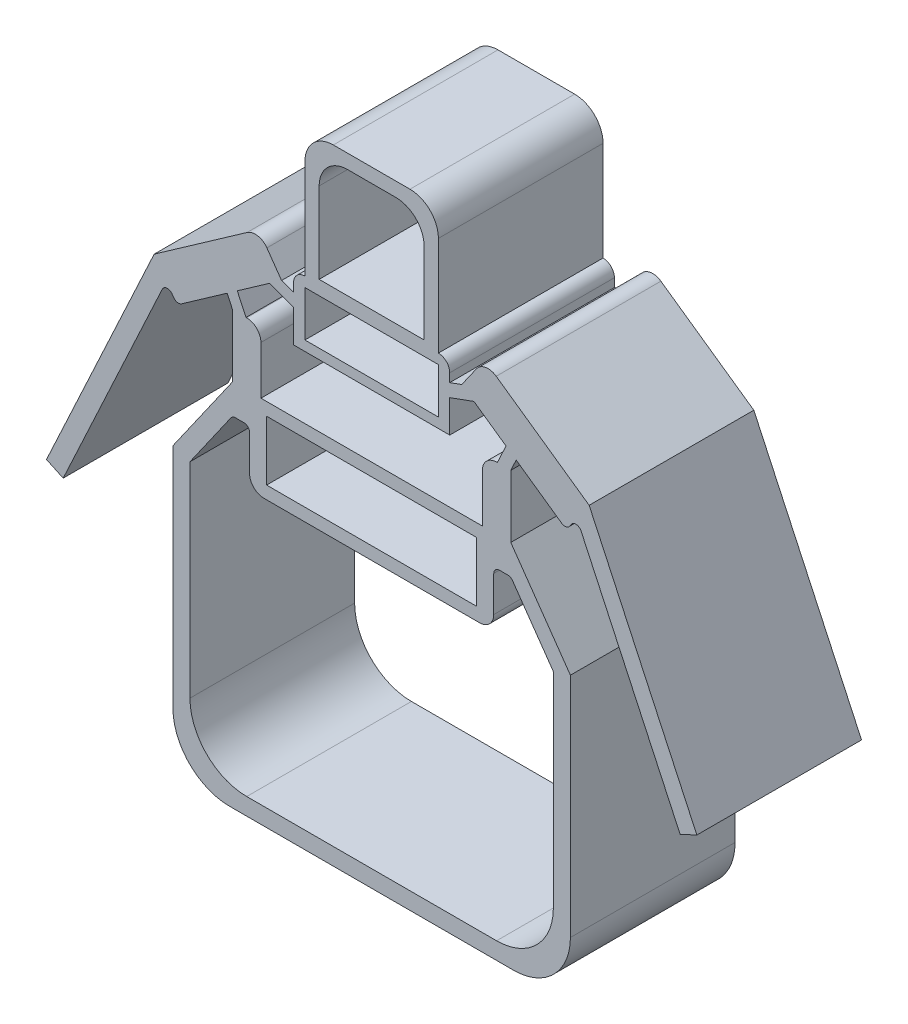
SolidWorks part; units mm, degrees
other "标注1"
sketch "草图17" plane through (-9.7594, -10.85, 5.8) normal (0, 0, 1) x (1, 0, 0)
ref_plane "前视基准面" through (0, 0, 0) normal (0, 0, 1) x (1, 0, 0)
ref_plane "上视基准面" through (0, 0, 0) normal (0, 1, 0) x (1, 0, 0)
ref_plane "右视基准面" through (0, 0, 0) normal (1, 0, 0) x (0, 0, -1)
other "Configuration Table"
sketch "草图1" plane through (0, 0, 0) normal (0, 0, 1) x (1, 0, 0)
  line L0 (2.75, 5.2) -> (3.1729, 5.3539)
  line L1 (-3.9, -1.4) -> (3.9, -1.4)
  line L2 (-3.9, -1.4) -> (-3.9, 1.4)
  line L4 (3.9, -1.4) -> (3.9, 0.1)
  line L5 (-3.9, -1.4) -> (3.9, 1.4) construction
  line L6 (-3.9, 1.4) -> (3.9, -1.4) construction
  line L7 (-2.75, 5.2) -> (2.75, 5.2)
  line L8 (-2.75, 5.2) -> (-2.75, 3.6)
  line L9 (-2.75, 3.6) -> (2.75, 3.6)
  line L10 (2.75, 4.7424) -> (2.75, 3.6)
  line L11 (-2.75, 5.2) -> (2.75, 3.6) construction
  line L12 (-2.75, 3.6) -> (2.75, 5.2) construction
  line L14 (3.9, 0.1) -> (4.9, 0.1)
  line L17 (3.9773, 6.4997) -> (3.1729, 5.3539)
  line L19 (3.9773, 6.4997) -> (7.6603, 3.9141)
  line L33 (2.75, 5.2) -> (2.75, 4.7424) construction
  line L34 (3.1729, 5.3539) -> (3.6021, 5.0525) construction
  line L37 (4.9, 3.6) -> (4.9, 0.1)
  line L38 (-3.9, 1.4) -> (3.9, 1.4)
  line L39 (3.9, 1.4) -> (3.9, 0.1) construction
  line L40 (0, 9.062) -> (0, -4.0269) construction
  line L41 (2.75, 4.7424) -> (3.6021, 5.0525)
  line L48 (3.6021, 5.0525) -> (4.7327, 4.2588)
  line L51 (4.4255, 3.6) -> (4.7327, 4.2588)
  line L53 (5.0902, 4.0078) -> (6.8558, 2.7682)
  line L55 (4.7327, 4.2588) -> (5.0902, 4.0078) construction
  line L56 (4.4255, 3.6) -> (4.9, 3.6) construction
  line L57 (3.9, 1.4) -> (3.9, 3.6)
  line L58 (3.9, 3.6) -> (4.4255, 3.6)
  line L59 (4.9, 3.6) -> (5.0902, 4.0078)
  line L60 (6.8558, 2.7682) -> (7.6603, 3.9141)
  point P0 (0, 0)
  point P6 (0, 4.4)
  dimension "D1" = 7.8
  dimension "D2" = 2.8
  dimension "D3" = 5.5
  dimension "D4" = 1.6
  dimension "D5" = 1
  dimension "D6" = 0.45
  dimension "D7" = 0.45
  dimension "D8" = 110
  dimension "D9" = 3.5
  dimension "D10" = 1.4
  dimension "D11" = 0.43
  dimension "D12" = 2.2
  dimension "D13" = 65
  dimension "D14" = 2.2
  dimension "D15" = 4.5
  dimension "D16" = 0.43
extrude "凸台-拉伸1" add sketch "草图1" along normal blind 5.8
mirror "镜向1" about plane through (0, 0, 0) normal (1, 0, 0) of "凸台-拉伸1"
sketch "草图10" plane through (0, 0, 5.8) normal (0, 0, 1) x (1, 0, 0)
  line L0 (-2.75, 3.6) -> (2.75, 3.6) construction
  line L1 (-3.7, -1.05) -> (3.7, -1.05)
  line L2 (-3.7, -1.05) -> (-3.7, 1.05)
  line L3 (-3.7, 1.05) -> (3.7, 1.05)
  line L4 (3.7, -1.05) -> (3.7, 1.05)
  line L5 (-3.7, -1.05) -> (3.7, 1.05) construction
  line L6 (-3.7, 1.05) -> (3.7, -1.05) construction
  line L7 (-2.35, 5.55) -> (2.35, 5.55)
  line L8 (-2.35, 5.55) -> (-2.35, 3.95)
  line L9 (-2.35, 3.95) -> (2.35, 3.95)
  line L10 (2.35, 5.55) -> (2.35, 3.95)
  point P0 (0, 0)
  point P10 (0, 5.55)
  dimension "D1" = 7.4
  dimension "D2" = 2.1
  dimension "D3" = 4.7
  dimension "D4" = 1.6
  dimension "D5" = 0.35
extrude "切除-拉伸3" cut sketch "草图10" against normal through all
sketch "草图11" plane through (0, 0, 5.8) normal (0, 0, 1) x (1, 0, 0)
  line L0 (-2.35, 5.2) -> (-2.75, 5.2)
  line L1 (-2.75, 5.2) -> (-2.75, 5.9)
  line L2 (-2.75, 5.9) -> (2.75, 5.9)
  line L3 (2.75, 5.9) -> (2.75, 5.2)
  line L4 (2.75, 3.6) -> (2.75, 4.7424) construction
  line L5 (2.75, 5.2) -> (2.35, 5.2)
  line L6 (2.35, 5.2) -> (2.35, 5.55)
  line L7 (2.35, 5.55) -> (-2.35, 5.55)
  line L8 (-2.35, 5.55) -> (-2.35, 5.2)
  line L9 (-2.35, 3.95) -> (2.35, 3.95) construction
  dimension "D1" = 0.35
  dimension "D2" = 1.6
extrude "凸台-拉伸2" add sketch "草图11" against normal up to surface (5.8 mm away)
fillet "圆角1" radius 0.4 2 edges at (-2.75, 5.9, 2.9) (2.75, 5.9, 2.9)
sketch "草图12" plane through (0, 0, 5.8) normal (0, 0, 1) x (1, 0, 0)
  line L0 (7.6603, 3.9141) -> (7.2293, 3.3002)
  line L1 (6.8558, 2.7682) -> (7.6603, 3.9141) construction
  line L2 (7.2293, 3.3002) -> (10.8647, -4.5212)
  line L3 (10.8647, -4.5212) -> (11.4537, -4.2474)
  line L4 (11.4537, -4.2474) -> (7.6603, 3.9141)
  line L5 (-7.6603, 3.9141) -> (-11.4537, -4.2474)
  line L6 (-11.4537, -4.2474) -> (-10.8647, -4.5212)
  line L7 (-10.8647, -4.5212) -> (-7.2293, 3.3002)
  line L8 (-6.8558, 2.7682) -> (-7.6603, 3.9141) construction
  line L9 (-7.2293, 3.3002) -> (-7.6603, 3.9141)
  dimension "D1" = 0.75
  dimension "D2" = 0.75
  dimension "D3" = 60
  dimension "D4" = 60
  dimension "D5" = 9
  dimension "D6" = 9
extrude "凸台-拉伸4" add sketch "草图12" against normal up to surface (5.8 mm away)
sketch "草图13" plane through (0, 0, 5.8) normal (0, 0, 1) x (1, 0, 0)
  line L0 (3.7, -1.05) -> (3.7, 1.05) construction
  line L1 (-3.7, 1.05) -> (3.7, 1.05)
  line L2 (-3.7, 1.05) -> (-3.7, 0.95)
  line L3 (-3.7, 0.95) -> (3.7, 0.95)
  line L4 (3.7, 1.05) -> (3.7, 0.95)
  line L5 (3.9, -1.4) -> (3.9, 0.1) construction
  line L6 (-3.9, -1.4) -> (3.9, -1.4)
  line L7 (-3.9, -1.4) -> (-3.9, -1.6)
  line L8 (-3.9, -1.6) -> (3.9, -1.6)
  line L9 (3.9, -1.4) -> (3.9, -1.6)
  dimension "D1" = 0.1
  dimension "D2" = 0.2
extrude "凸台-拉伸5" add sketch "草图13" against normal up to surface (5.8 mm away)
sketch "草图14" plane through (0, 0, 5.8) normal (0, 0, 1) x (1, 0, 0)
  line L0 (3.7, -1.05) -> (3.7, 0.95) construction
  line L1 (-3.7, -1.05) -> (3.7, -1.05)
  line L2 (-3.7, -1.05) -> (-3.7, -1.15)
  line L3 (-3.7, -1.15) -> (3.7, -1.15)
  line L4 (3.7, -1.05) -> (3.7, -1.15)
  dimension "D1" = 0.1
extrude "切除-拉伸4" cut sketch "草图14" against normal through all
sketch "草图15" plane through (0, 0, 5.8) normal (0, 0, 1) x (1, 0, 0)
  line L2 (2.35, 10.4) -> (-2.35, 10.4)
  line L3 (2.35, 5.9) -> (-2.35, 5.9) construction
  line L4 (-2.35, 5.9) -> (2.35, 5.9)
  line L34 (-7, -1.5991) -> (-7, -11.6)
  line L35 (-7, -11.6) -> (7, -11.6)
  line L36 (7, -11.6) -> (7, -1.5991)
  line L41 (6.4, -1.7883) -> (6.4, -11)
  line L42 (6.4, -11) -> (-6.4, -11)
  line L43 (-6.4, -11) -> (-6.4, -1.7883)
  line L45 (-2.35, 5.9) -> (-2.35, 10.4)
  line L46 (-3.9, -1.6) -> (3.9, -1.6) construction
  line L61 (-1.85, 6.05) -> (1.85, 6.05)
  line L67 (4.9, 1.4) -> (7, -1.5991)
  line L68 (4.9, 0.1) -> (4.9, 3.6) construction
  line L69 (6.4, -1.7883) -> (4.9, 0.3539)
  line L70 (-7, -1.5991) -> (-4.9, 1.4)
  line L71 (-4.9, 0.1) -> (-4.9, 3.6) construction
  line L72 (-6.4, -1.7883) -> (-4.9, 0.3539)
  line L73 (3.9, 1.4) -> (-3.9, 1.4) construction
  line L74 (-4.9, 1.4) -> (-4.9, 0.3539)
  line L75 (4.9, 1.4) -> (4.9, 0.3539)
  line L76 (4.7404, 9.8178) -> (0.8422, 6.8942) construction
  line L77 (4.7404, 9.8178) -> (4.7404, 9.7307) construction
  line L78 (2.35, 10.4) -> (4.7404, 9.7307) construction
  line L79 (4.8904, 10.1178) -> (0.5817, 6.8863) construction
  line L80 (4.8904, 10.1178) -> (4.8904, 9.5329) construction
  line L81 (2.3294, 10.25) -> (4.8904, 9.5329) construction
  line L82 (-4.2754, 8.4572) -> (0.1678, 7.5601) construction
  line L83 (-2.3294, 10.25) -> (-5.82, 9.2726) construction
  line L84 (-5.82, 9.2726) -> (-4.2309, 8.6013) construction
  line L85 (-6.2735, 9.3014) -> (-4.2754, 8.4572) construction
  line L86 (-2.35, 10.4) -> (-6.2735, 9.3014) construction
  line L87 (-4.2309, 8.6013) -> (0.5541, 7.6351) construction
  line L88 (-2.35, 5.9) -> (0.1678, 7.5601) construction
  line L89 (2.35, 5.9) -> (0.8422, 6.8942) construction
  line L90 (2.35, 5.9) -> (2.35, 10.4)
  line L91 (-1.85, 6.05) -> (-1.85, 9.9)
  line L92 (2.3294, 10.25) -> (-2.3294, 10.25) construction
  line L93 (-1.85, 6.05) -> (0.5541, 7.6351) construction
  line L94 (1.85, 6.05) -> (0.5817, 6.8863) construction
  line L95 (-1.85, 9.9) -> (1.85, 9.9)
  line L96 (1.85, 9.9) -> (1.85, 6.05)
  point P14 (0, 7.4)
  point P32 (0, -11)
  dimension "D2" = 0.6
  dimension "D4" = 12.8
  dimension "D5" = 9.4
  dimension "D6" = 0.6
  dimension "D7" = 0.6
  dimension "D8" = 0.6
  dimension "D3" = 4.5
  dimension "D9" = 0.15
  dimension "D10" = 0.5
  dimension "D11" = 0.5
  dimension "D12" = 0.5
  dimension "D13" = 0.6
  dimension "D14" = 35
  dimension "D15" = 35
extrude "凸台-拉伸6" add sketch "草图15" against normal up to surface (5.8 mm away)
sketch "草图21" plane through (0, 0, 5.8) normal (0, 0, 1) x (1, 0, 0)
  line L0 (-4.9, 0.3539) -> (-4.9, 0.1)
  line L1 (-4.9, 0.1) -> (-3.9, 0.1)
  line L2 (-3.9, 0.1) -> (-3.9, 0.3539)
  line L3 (-3.9, 0.3539) -> (-4.9, 0.3539)
  line L4 (3.9, 0.1) -> (4.9, 0.1)
  line L5 (4.9, 0.1) -> (4.9, 0.3539)
  line L6 (4.9, 0.3539) -> (3.9, 0.3539)
  line L7 (3.9, 0.3539) -> (3.9, 0.1)
extrude "切除-拉伸6" cut sketch "草图21" against normal through all
fillet "圆角2" radius 0.5 2 edges at (-3.9, 3.6, 2.9) (3.9, 3.6, 2.9)
sketch "草图22" plane through (0, 0, 5.8) normal (0, 0, 1) x (1, 0, 0)
  line L0 (-4.9, 1.4) -> (4.9, 1.4) construction
  line L1 (4.9, 1.4) -> (7, -1.5991) construction
  line L2 (7, -1.5991) -> (7, -11.6) construction
  line L3 (7, -11.6) -> (-7, -11.6) construction
  line L4 (-7, -11.6) -> (-7, -1.5991) construction
  line L5 (-7, -1.5991) -> (-4.9, 1.4) construction
  line L6 (-4.671, 0.96) -> (4.671, 0.96)
  line L7 (4.671, 0.96) -> (6.56, -1.7378)
  line L8 (6.56, -1.7378) -> (6.56, -11.16)
  line L9 (6.56, -11.16) -> (-6.56, -11.16)
  line L10 (-6.56, -11.16) -> (-6.56, -1.7378)
  line L11 (-6.56, -1.7378) -> (-4.671, 0.96)
  dimension "D1" = 0.44
extrude "凸台-拉伸15" [suppressed] add sketch "草图22" along normal blind 0.2
fillet "圆角3" radius 1 4 edges at (-1.85, 9.9, 2.9) (1.85, 9.9, 2.9) (2.35, 10.4, 2.9) (-2.35, 10.4, 2.9)
fillet "圆角4" radius 2 4 edges at (7, -11.6, 2.9) (-7, -11.6, 2.9) (6.4, -11, 2.9) (-6.4, -11, 2.9)
sketch "草图23" plane through (0, 0, 5.8) normal (0, 0, 1) x (1, 0, 0)
  line L0 (-3.9, -1.6) -> (3.9, -1.6) construction
  line L1 (3.9, 0.3539) -> (4.3, 0.3539)
  line L2 (3.9, 0.3539) -> (3.9, -1.6)
  line L3 (3.9, -1.6) -> (4.3, -1.6)
  line L4 (4.3, 0.3539) -> (4.3, -1.6)
  line L5 (-3.9, 0.3539) -> (-4.3, 0.3539)
  line L6 (-3.9, 0.3539) -> (-3.9, -1.6)
  line L7 (-3.9, -1.6) -> (-4.3, -1.6)
  line L8 (-4.3, 0.3539) -> (-4.3, -1.6)
  dimension "D1" = 0.4
  dimension "D2" = 0.4
extrude "凸台-拉伸16" add sketch "草图23" against normal up to surface (5.8 mm away)
fillet "圆角5" radius 0.2 4 edges at (-4.9, 0.3539, 2.9) (-4.3, 0.3539, 2.9) (4.3, 0.3539, 2.9) (4.9, 0.3539, 2.9)
fillet "圆角6" radius 0.5 2 edges at (4.3, -1.6, 2.9) (-4.3, -1.6, 2.9)
fillet "圆角7" radius 0.2 4 edges at (7.2293, 3.3002, 2.9) (-7.2293, 3.3002, 2.9) (-6.8558, 2.7682, 2.9) (6.8558, 2.7682, 2.9)
fillet "圆角8" radius 0.5 2 edges at (3.9773, 6.4997, 2.9) (-3.9773, 6.4997, 2.9)
